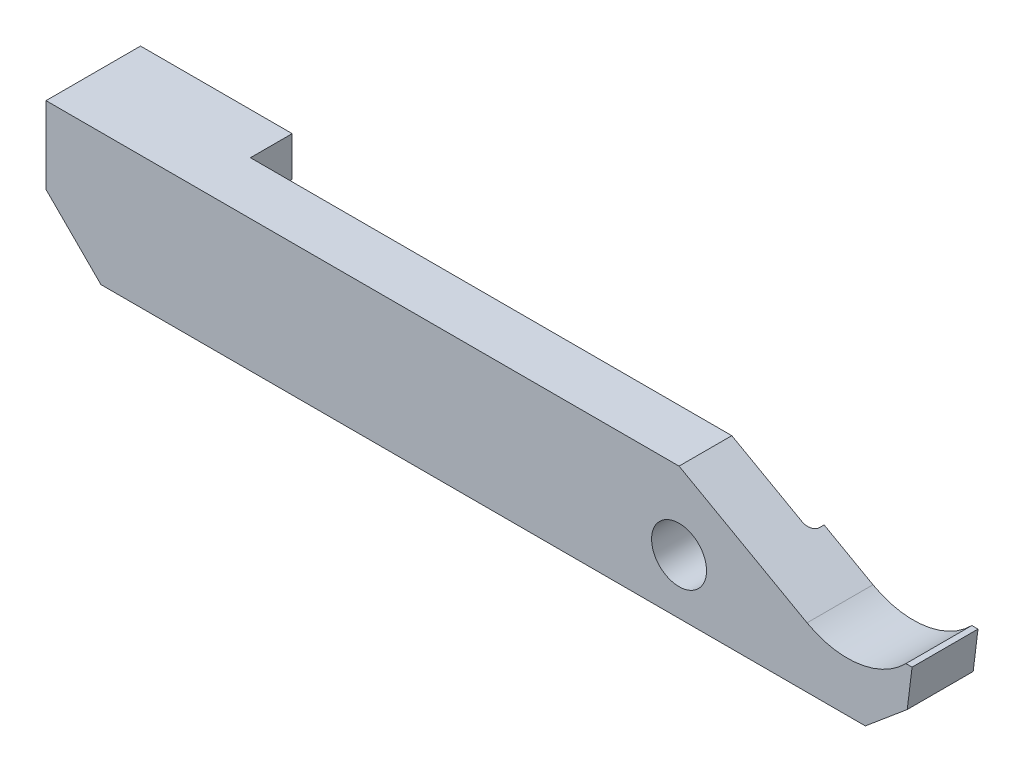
SolidWorks part; units mm, degrees
ref_plane "Front Plane" through (0, 0, 0) normal (0, 0, 1) x (1, 0, 0)
ref_plane "Top Plane" through (0, 0, 0) normal (0, 1, 0) x (1, 0, 0)
ref_plane "Right Plane" through (0, 0, 0) normal (1, 0, 0) x (0, 0, -1)
sketch "Sketch1" plane through (0, 0, 0) normal (0, 0, 1) x (1, 0, 0)
  line L0 (3.175, 0) -> (47.3388, 0)
  line L1 (0, 3.175) -> (0, 7.62)
  line L2 (0, 7.62) -> (36.576, 7.62)
  line L3 (0, 3.175) -> (3.175, 0)
  line L4 (36.576, 3.175) -> (36.576, 10.574) construction
  line L5 (49.6822, 4.2926) -> (50.038, 4.2926)
  line L6 (50.038, 4.2926) -> (49.7604, 2.032)
  line L7 (49.7604, 2.032) -> (47.3388, 0)
  line L8 (50.038, 4.2926) -> (50.038, -3.7748) construction
  line L9 (36.576, 7.62) -> (43.9708, 3.4764)
  line L10 (36.576, 3.175) -> (49.2127, 3.175) construction
  circle A0 centre (36.576, 3.175) radius 1.5875
  arc A1 (43.9708, 3.4764) -> (49.6822, 4.2926) centre (46.2926, 7.62) ccw
  point P0 (0, 0)
  dimension "D5" = 3.175
  dimension "D11" = 4.7498
  dimension "D1" = 7.62
  dimension "D2" = 36.576
  dimension "D3" = 3.175
  dimension "D6" = 4.2926
  dimension "D7" = 13.462
  dimension "D8" = 40
  dimension "D9" = 7
  dimension "D10" = 2.032
  dimension "D13" = 7.62
extrude "Boss-Extrude1" add sketch "Sketch1" against normal blind 3.81 contours A1 L9 L2 L1 L3 L0 L7 L6 L5 A0
sketch "Sketch2" plane through (0, 7.62, 0) normal (0, 1, 0) x (1, 0, 0)
  line L0 (0, 3.81) -> (0, 0) construction
  line L1 (0, 3.048) -> (40.64, 3.048)
  line L2 (0, 3.048) -> (0, 5.588)
  line L3 (0, 5.588) -> (41.148, 5.588)
  line L4 (41.148, 3.556) -> (41.148, 5.588)
  line L5 (0, 0) -> (36.576, 0) construction
  arc A0 (40.64, 3.048) -> (41.148, 3.556) centre (40.64, 3.556) ccw
  dimension "D1" = 0.508
  dimension "D2" = 3.048
  dimension "D3" = 2.54
  dimension "D4" = 41.148
extrude "Cut-Extrude1" cut sketch "Sketch2" against normal through all
sketch "Sketch3" plane through (0, 0, -3.048) normal (0, 0, -1) x (-1, 0, 0)
  line L0 (-3.175, 0) -> (-40.64, 0) construction
  line L1 (0, 7.62) -> (-8.763, 7.62)
  line L2 (0, 7.62) -> (0, 5.334)
  line L3 (0, 5.334) -> (-8.763, 5.334)
  line L4 (-8.763, 7.62) -> (-8.763, 5.334)
  dimension "D1" = 5.334
  dimension "D2" = 8.763
extrude "Boss-Extrude2" add sketch "Sketch3" along normal blind 5.461 from surface at -3.048
